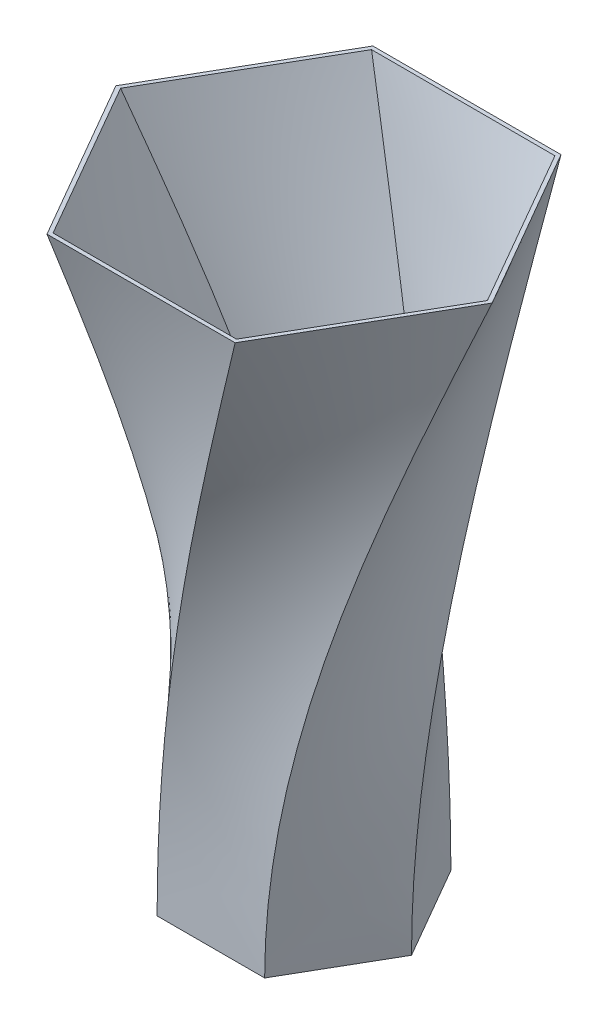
SolidWorks part; units mm, degrees
ref_plane "Front Plane" through (0, 0, 0) normal (0, 0, 1) x (1, 0, 0)
ref_plane "Top Plane" through (0, 0, 0) normal (0, 1, 0) x (1, 0, 0)
ref_plane "Right Plane" through (0, 0, 0) normal (1, 0, 0) x (0, 0, -1)
sketch "Sketch1" plane through (0, 0, 0) normal (0, 1, 0) x (1, 0, 0)
  line L1 (28.8675, 50) -> (-28.8675, 50)
  line L2 (-28.8675, 50) -> (-57.735, 0)
  line L3 (-57.735, 0) -> (-28.8675, -50)
  line L4 (-28.8675, -50) -> (28.8675, -50)
  line L5 (28.8675, -50) -> (57.735, 0)
  line L6 (57.735, 0) -> (28.8675, 50)
  circle A0 centre (0, 0) radius 50 construction
  dimension "D1" = 100
ref_plane "Plane1" through (0, 325, 0) normal (0, 1, 0) x (1, 0, 0)
sketch "Sketch2" plane through (0, 325, 0) normal (0, 1, 0) x (1, 0, 0)
  line L1 (50.5181, 87.5) -> (-50.5181, 87.5)
  line L2 (-50.5181, 87.5) -> (-101.0363, 0)
  line L3 (-101.0363, 0) -> (-50.5181, -87.5)
  line L4 (-50.5181, -87.5) -> (50.5181, -87.5)
  line L5 (50.5181, -87.5) -> (101.0363, 0)
  line L6 (101.0363, 0) -> (50.5181, 87.5)
  circle A0 centre (0, 0) radius 87.5 construction
  dimension "D1" = 175
loft "Loft1" add profiles "Sketch1", "Sketch2"
shell "Shell1" thickness 2
